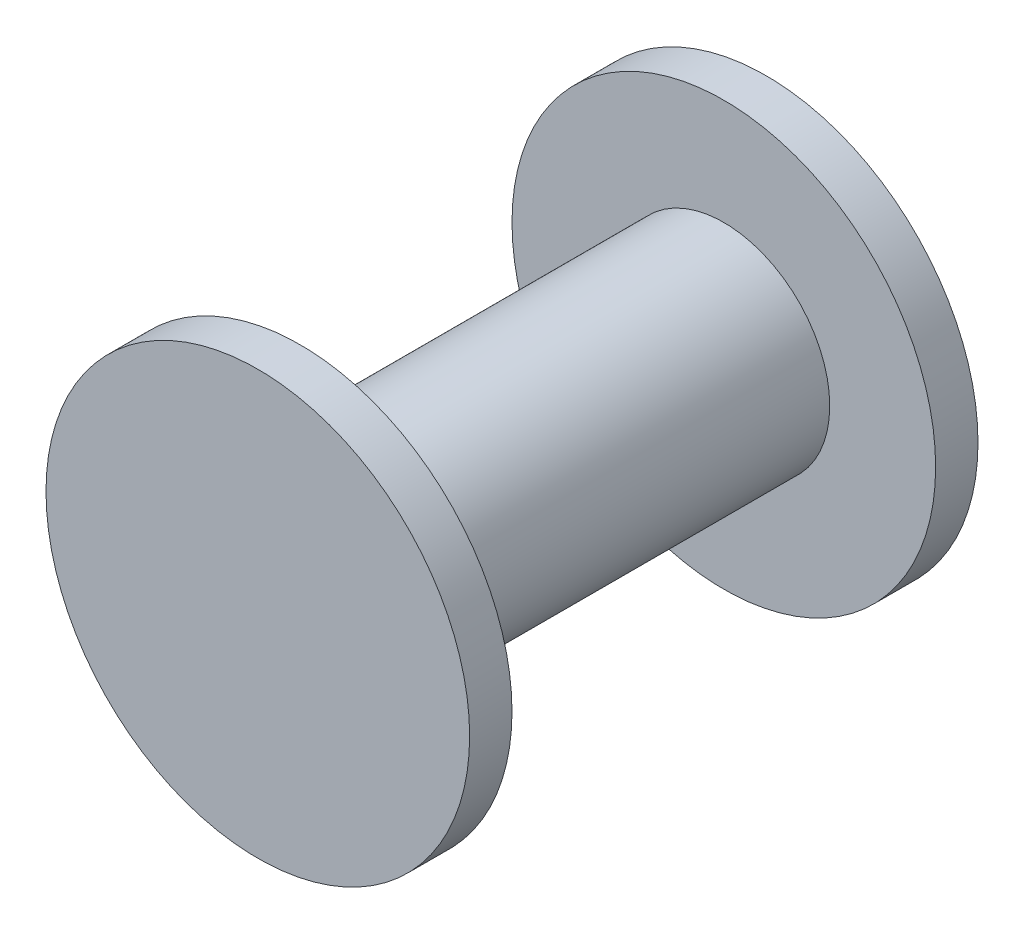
SolidWorks part; units mm, degrees
ref_plane "前视基准面" through (0, 0, 0) normal (0, 0, 1) x (1, 0, 0)
ref_plane "上视基准面" through (0, 0, 0) normal (0, 1, 0) x (1, 0, 0)
ref_plane "右视基准面" through (0, 0, 0) normal (1, 0, 0) x (0, 0, -1)
other "Configuration Table"
sketch "草图1" plane through (0, 0, 0) normal (0, 0, 1) x (1, 0, 0)
  circle A0 centre (0, 0) radius 20
  dimension "D1" = 40
extrude "Rotor_Shaft_and_Flanges" add sketch "草图1" against normal mid plane 48
sketch "草图2" plane through (0, 0, 0) normal (0, 0, 1) x (1, 0, 0)
  circle A0 centre (0, 0) radius 20
  circle A1 centre (0, 0) radius 10
  dimension "D1" = 20
  dimension "D2" = 40
extrude "Rotor_D20_Flanges_D40" cut sketch "草图2" against normal mid plane 40
